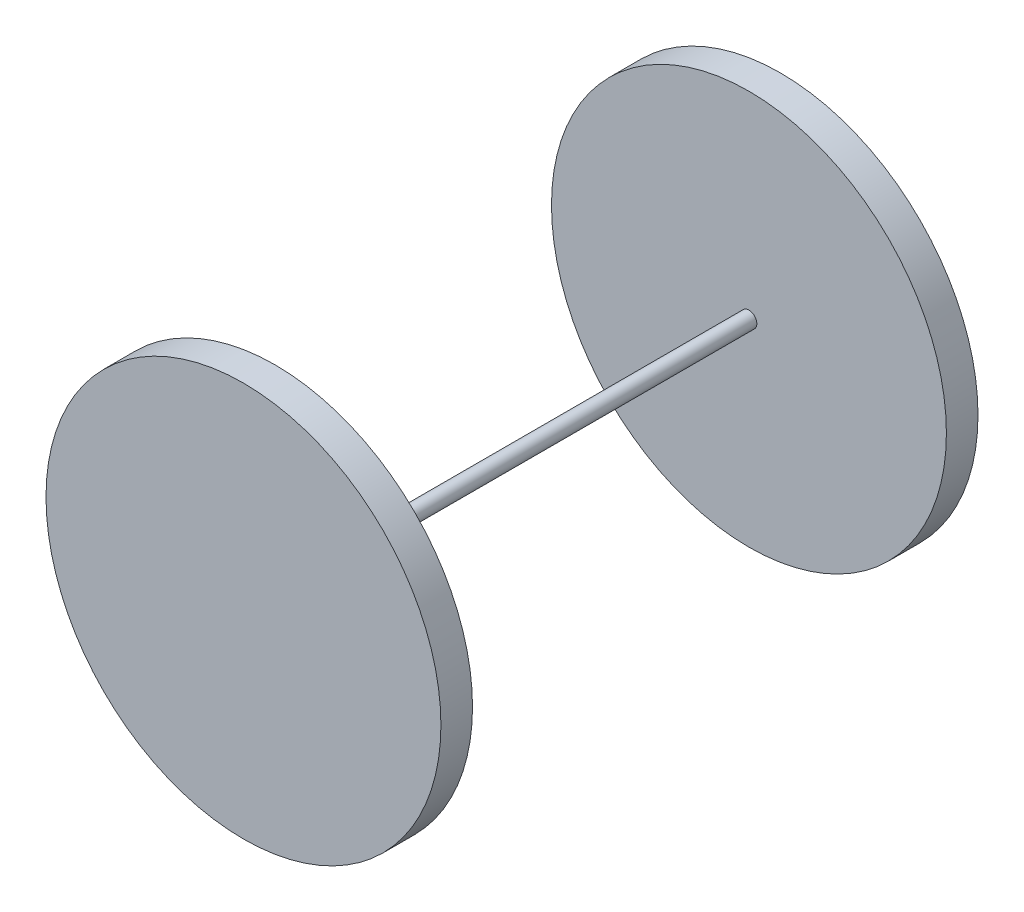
SolidWorks part; units mm, degrees
ref_plane "Plan de face" through (0, 0, 0) normal (0, 0, 1) x (1, 0, 0)
ref_plane "Plan de dessus" through (0, 0, 0) normal (0, 1, 0) x (1, 0, 0)
ref_plane "Plan de droite" through (0, 0, 0) normal (1, 0, 0) x (0, 0, -1)
sketch "Esquisse1" plane through (0, 0, 0) normal (0, 0, 1) x (1, 0, 0)
  circle A0 centre (0, 0) radius 125
  dimension "D1" = 250
extrude "Extrusion1" add sketch "Esquisse1" along normal blind 20
sketch "Esquisse2" plane through (0, 0, 20) normal (0, 0, 1) x (1, 0, 0)
  circle A0 centre (0, 0) radius 5
  dimension "D1" = 10
extrude "Extrusion2" add sketch "Esquisse2" along normal blind 300
sketch "Esquisse3" plane through (0, 0, 320) normal (0, 0, 1) x (1, 0, 0)
  circle A0 centre (0, 0) radius 125
  dimension "D1" = 250
extrude "Extrusion3" add sketch "Esquisse3" along normal blind 20
